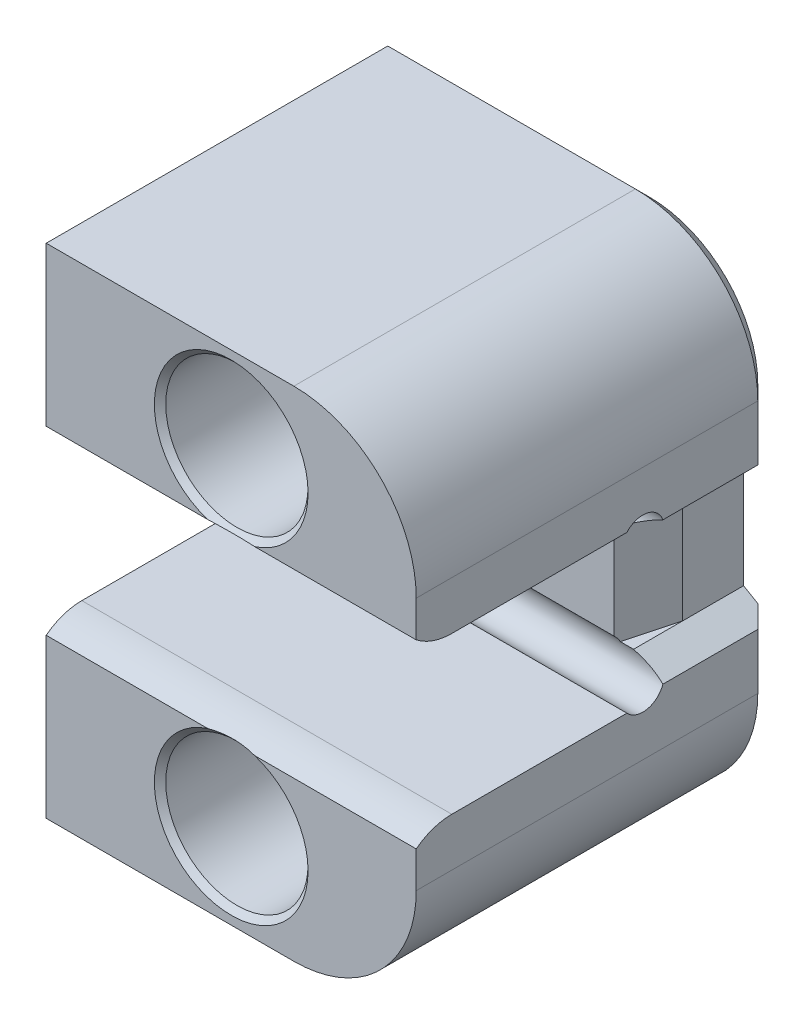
SolidWorks part; units mm, degrees
ref_plane "Front Plane" through (0, 0, 0) normal (0, 0, 1) x (1, 0, 0)
ref_plane "Top Plane" through (0, 0, 0) normal (0, 1, 0) x (1, 0, 0)
ref_plane "Right Plane" through (0, 0, 0) normal (1, 0, 0) x (0, 0, -1)
sketch "Sketch1" plane through (0, 0, 0) normal (1, 0, 0) x (0, 0, -1)
  line L0 (0, 0) -> (50000, 0) construction
  line L1 (0, 5.5) -> (16.92, 5.5)
  line L2 (0, 17.5) -> (25, 17.5)
  line L3 (0, 17.5) -> (0, 5.5)
  line L4 (0, -17.5) -> (25, -17.5)
  line L5 (25, 17.5) -> (25, -17.5)
  line L6 (16.92, 5.5) -> (16.92, -5.5)
  line L7 (16.92, -5.5) -> (0, -5.5)
  line L9 (0, 14.3) -> (0, -14.3) construction
  line L10 (0, -5.5) -> (0, -17.5)
  dimension "D1" = 25
  dimension "D2" = 35
  dimension "D3" = 16.92
  dimension "D4" = 11
extrude "Extrude1" add sketch "Sketch1" along normal mid plane 26
fillet "Fillet1" radius 8.6 2 edges at (13, 17.5, -12.5) (13, -17.5, -12.5)
sketch "Sketch2" plane through (-12, 0, 0) normal (0, 0, 1) x (1, 0, 0)
  line L0 (0, 0) -> (50000, 0) construction
  line L1 (25, 5.5) -> (25, -5.5) construction
  line L3 (-1, -5.5) -> (-1, -17.5) construction
  line L6 (25, -5) -> (23, -3.8453)
  line L10 (23, -3.8453) -> (23, 3.8453)
  line L11 (25, 5) -> (23, 3.8453)
  line L12 (25, -5) -> (25, 5)
  point P20 (-1, -5)
  point P21 (-1, 5)
  dimension "D1" = 10
  dimension "D2" = 2
  dimension "D3" = 30
extrude "Cut-Extrude1" cut sketch "Sketch2" against normal through all
sketch "Sketch5" plane through (13, 0, 0) normal (1, 0, 0) x (0, 0, -1)
  line L0 (0, 0) -> (50000, 0) construction
  line L1 (0, 5.5) -> (16.92, 5.5) construction
  line L2 (0, 8.9) -> (0, 5.5) construction
  line L3 (0, -5.5) -> (0, -8.9) construction
  line L4 (-7.5, -1.359) -> (2.5, -1.359)
  line L5 (-7.5, -1.359) -> (-7.5, -6.359)
  line L6 (-7.5, -6.359) -> (0, -6.359)
  line L7 (2.5, -1.359) -> (2.5, -5.5)
  line L8 (16.92, -5.5) -> (0, -5.5) construction
  line L9 (2.5, 1.359) -> (2.5, 5.5)
  line L10 (-7.5, 6.359) -> (0, 6.359)
  line L11 (-7.5, 1.359) -> (-7.5, 6.359)
  line L12 (-7.5, 1.359) -> (2.5, 1.359)
  arc A0 (0.3261, -5.8903) -> (2.5, -5.5) centre (2.5, -11.75) cw construction
  arc A1 (0, -6.359) -> (0.3261, -5.8903) centre (0.5, -6.359) cw construction
  arc A2 (0, 6.359) -> (0.3261, 5.8903) centre (0.5, 6.359) ccw construction
  arc A3 (0.3261, 5.8903) -> (2.5, 5.5) centre (2.5, 11.75) ccw construction
  arc A4 (0, 6.359) -> (2.5, 5.5) centre (2.5, 9.5673) ccw
  arc A5 (0, -6.359) -> (2.5, -5.5) centre (2.5, -9.5673) cw
  dimension "D1" = 0.5
  dimension "D2" = 6.25
  dimension "D3" = 5
  dimension "D4" = 10
  dimension "D5" = 2.5
extrude "Cut-Extrude2" cut sketch "Sketch5" against normal through all
sketch "Sketch6" plane through (13, 0, 0) normal (1, 0, 0) x (0, 0, -1)
  line L0 (0, 0) -> (50000, 0) construction
  line L3 (16.92, 5.5) -> (16.92, 5) construction
  line L4 (2.5, 5.5) -> (16.92, 5.5) construction
  circle A0 centre (15.92, 4.5) radius 1.5
  circle A1 centre (15.92, -4.5) radius 1.5
  dimension "D2" = 0.5
  dimension "D3" = 1.5
  dimension "D1" = 0.5
extrude "Cut-Extrude3" cut sketch "Sketch6" against normal through all
hole_wizard "CBORE for M5 SHCS1" positions "Sketch8" profile "Sketch7" counterbore size "M5" standard "Ansi Metric"
sketch "Sketch8" plane through (0, 0, 0) normal (0, 0, 1) x (1, 0, 0)
  line L0 (0, 0) -> (50000, 0) construction
  point P0 (0, 11.5)
  point P5 (0, -11.5)
  dimension "D1" = 23
sketch "Sketch7" plane through (0, 11.5, 0) normal (1, 0, 0) x (0, -1, 0)
  line L0 (0, 0) -> (0, 25)
  line L1 (0, 25) -> (2.9, 25)
  line L3 (2.9, 25) -> (2.9, 7.5)
  line L4 (2.9, 7.5) -> (5, 7.5)
  line L5 (5, 7.5) -> (5, 0)
  line L7 (5, 0) -> (0, 0)
  line L11 (0, -6.35) -> (0, 107.95) construction
  dimension "Thru Hole Dia." = 5.8
  dimension "Thru Hole Depth" = 25
  dimension "C'Bore Dia." = 10
  dimension "C'Bore Depth" = 7.5
chamfer "Chamfer1" distance 1 angle 45 6 edges at (-4.3, -17.5, -25) (-4.3, 17.5, -25) (10.4811, -14.9811, -25) (13, -6.95, -25) (13, 6.95, -25) (10.4811, 14.9811, -25)
chamfer "Chamfer3" distance 0.4 angle 45 2 edges at (5, -11.5, 0) (5, 11.5, 0)
sketch "Sketch9" plane through (0, 0, 0) normal (0, 1, 0) x (1, 0, 0)
  line L1 (11, 16.92) -> (11, 20.72)
  line L5 (11, 16.92) -> (-13, 16.92) construction
  line L6 (11, 25) -> (11, 17.2696) construction
  line L7 (11, 20.72) -> (9.9818, 16.92)
  line L8 (9.9818, 16.92) -> (11, 16.92)
  dimension "D3" = 3.8
  dimension "D4" = 15
extrude "Cut-Extrude4" cut sketch "Sketch9" against normal up to vertex and the other way up to vertex
